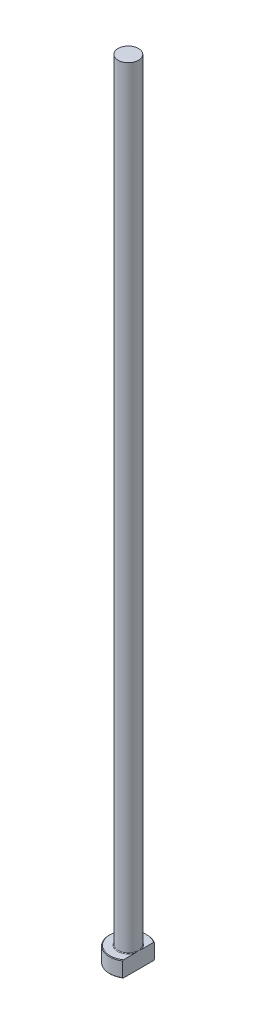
SolidWorks part; units mm, degrees
ref_plane "Front Plane" through (0, 0, 0) normal (0, 0, 1) x (1, 0, 0)
ref_plane "Top Plane" through (0, 0, 0) normal (0, 1, 0) x (1, 0, 0)
ref_plane "Right Plane" through (0, 0, 0) normal (1, 0, 0) x (0, 0, -1)
sketch "Sketch1" plane through (0, 0, 0) normal (0, 0, 1) x (1, 0, 0)
  line L0 (0, 259.9588) -> (0, -15.1925) construction
  line L1 (0, 0) -> (-6, 0)
  line L2 (-6, 0) -> (-6, 5)
  line L3 (-6, 5) -> (-3.25, 5)
  line L4 (-3.25, 5) -> (-3.25, 250)
  line L5 (-3.25, 250) -> (0, 250)
  line L6 (0, 250) -> (0, 0)
  dimension "L" = 250
  dimension "H" = 12
  dimension "T" = 5
  dimension "D" = 6.5
revolve "Revolve1" add sketch "Sketch1" angle 360 about L0
chamfer "Chamfer1" distance 0.2 angle 45 2 edges at (0, 5, 6) (0, 0, 6)
fillet "Fillet1" radius 0.2 1 edges at (0, 5, 3.25)
sketch "Sketch2" plane through (0, 0, 0) normal (0, 1, 0) x (1, 0, 0)
  line L0 (3.25, 5.0436) -> (3.25, -5.0436)
  circle A0 centre (0, 0) radius 6 construction
  arc A1 (3.25, -5.0436) -> (3.25, 5.0436) centre (0, 0) ccw
  circle A2 centre (0, 0) radius 3.25 construction
extrude "KEY" cut sketch "Sketch2" along normal through all
